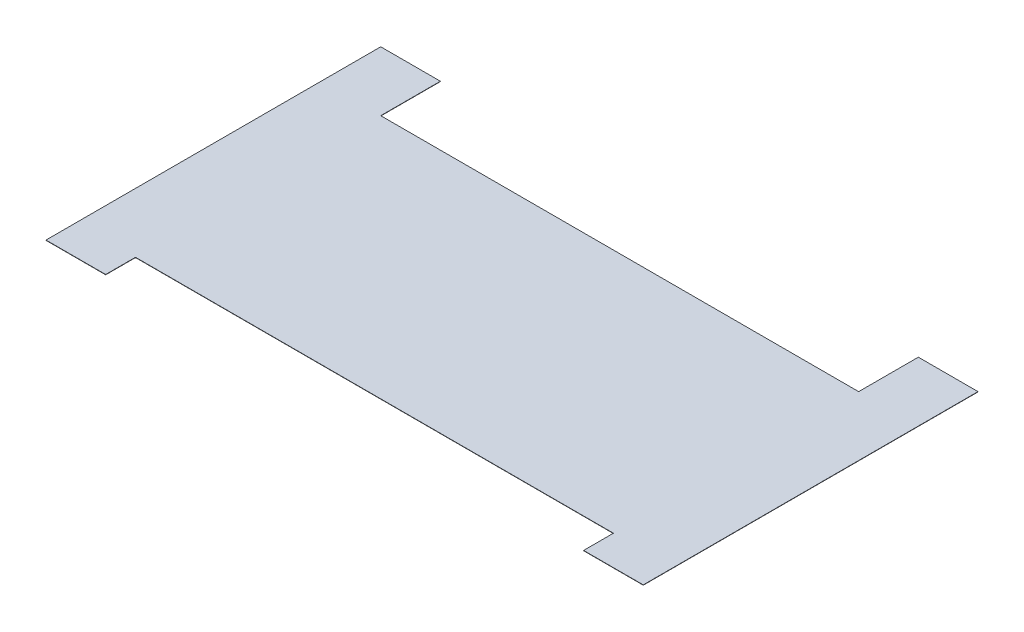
SolidWorks part; units mm, degrees
ref_plane "Front Plane" through (0, 0, 0) normal (0, 0, 1) x (1, 0, 0)
ref_plane "Top Plane" through (0, 0, 0) normal (0, 1, 0) x (1, 0, 0)
ref_plane "Right Plane" through (0, 0, 0) normal (1, 0, 0) x (0, 0, -1)
sketch "Sketch1" plane through (0, 0, 0) normal (0, 1, 0) x (1, 0, 0)
  line L0 (0, 0) -> (0, 56.1)
  line L1 (0, 56.1) -> (10, 56.1)
  line L2 (10, 56.1) -> (10, 46.1)
  line L3 (10, 46.1) -> (90.1, 46.1)
  line L4 (90.1, 46.1) -> (90.1, 56.1)
  line L5 (90.1, 56.1) -> (100.1, 56.1)
  line L6 (100.1, 56.1) -> (100.1, 0)
  line L7 (100.1, 0) -> (90.1, 0)
  line L8 (90.1, 0) -> (90.1, 5)
  line L9 (90.1, 5) -> (10, 5)
  line L10 (10, 5) -> (10, 0)
  line L11 (10, 0) -> (0, 0)
  dimension "D2" = 10
  dimension "D1" = 56.1
  dimension "D3" = 10
  dimension "D4" = 80.1
  dimension "D5" = 10
  dimension "D6" = 5
  dimension "D7" = 56.1
extrude "Boss-Extrude1" add sketch "Sketch1" along normal blind 0.05
